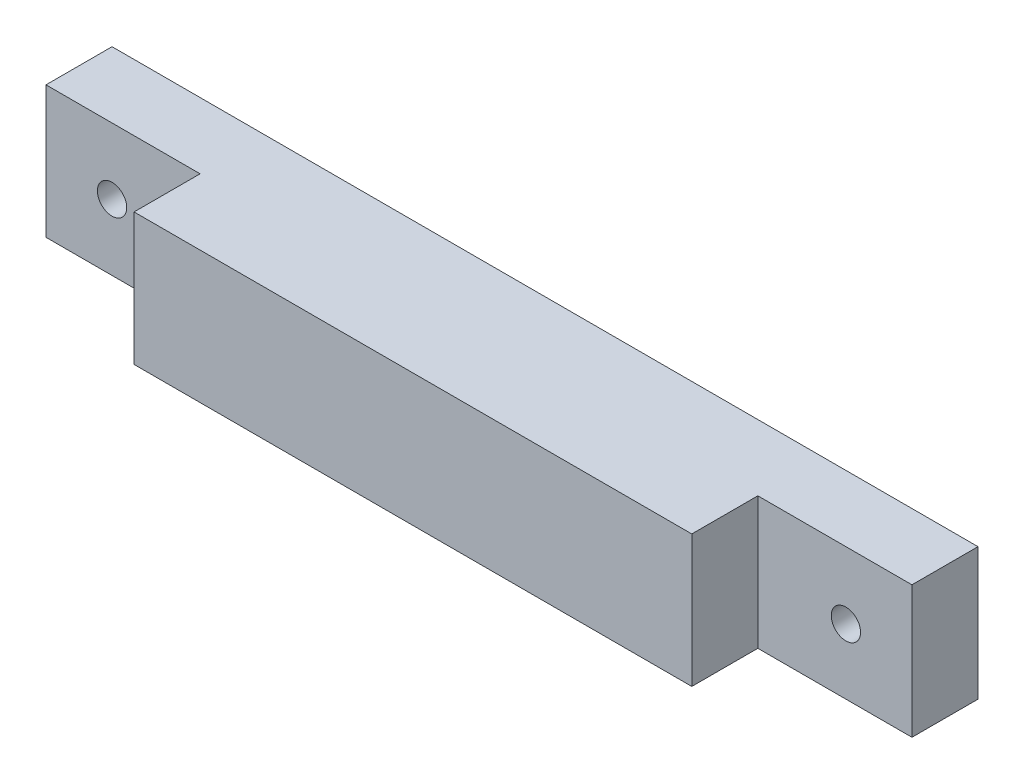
SolidWorks part; units mm, degrees
ref_plane "Plan de face" through (0, 0, 0) normal (0, 0, 1) x (1, 0, 0)
ref_plane "Plan de dessus" through (0, 0, 0) normal (0, 1, 0) x (1, 0, 0)
ref_plane "Plan de droite" through (0, 0, 0) normal (1, 0, 0) x (0, 0, -1)
sketch "Esquisse1" plane through (0, 0, 0) normal (0, 0, 1) x (1, 0, 0)
  line L1 (0, 0) -> (59, 0)
  line L2 (0, 0) -> (0, 9)
  line L3 (0, 9) -> (59, 9)
  line L4 (59, 0) -> (59, 9)
  dimension "D1" = 59
  dimension "D2" = 9
extrude "Extrusion1" add sketch "Esquisse1" along normal blind 9
sketch "Esquisse2" plane through (0, 0, 9) normal (0, 0, 1) x (1, 0, 0)
  line L0 (0, 0) -> (59, 0) construction
  line L1 (0, 9) -> (10.5, 9)
  line L2 (0, 9) -> (0, 0)
  line L3 (0, 0) -> (10.5, 0)
  line L4 (10.5, 9) -> (10.5, 0)
  line L5 (59, 9) -> (0, 9) construction
  line L6 (59, 0) -> (48.5, 0)
  line L7 (59, 0) -> (59, 9)
  line L8 (59, 9) -> (48.5, 9)
  line L9 (48.5, 0) -> (48.5, 9)
  dimension "D1" = 10.5
  dimension "D2" = 10.5
extrude "Enlèv. mat.-Extru.1" cut sketch "Esquisse2" against normal blind 4.5
sketch "Esquisse4" plane through (0, 0, 4.5) normal (0, 0, 1) x (1, 0, 0)
  line L0 (0, 9) -> (0, 0) construction
  line L1 (59, 0) -> (59, 9) construction
  line L2 (48.5, 0) -> (59, 0) construction
  line L3 (0, 0) -> (10.5, 0) construction
  circle A0 centre (4.5, 4.5) radius 1
  circle A1 centre (54.5, 4.4371) radius 1
  point P4 (0, 4.5)
  point P9 (53.75, 0)
  dimension "D5" = 2
  dimension "D6" = 2
  dimension "D1" = 4.5
  dimension "D2" = 4.5
  dimension "D3" = 4.5
  dimension "D4" = 4.5
extrude "Enlèv. mat.-Extru.2" cut sketch "Esquisse4" against normal blind 4.5
